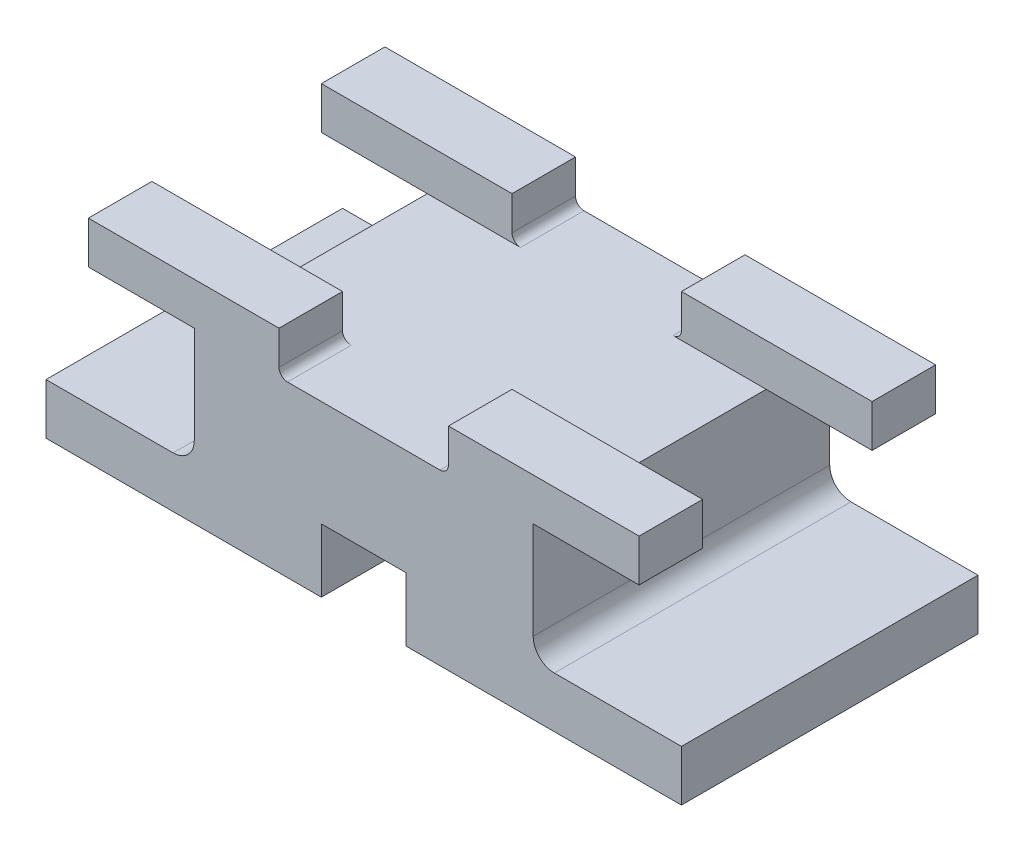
SolidWorks part; units mm, degrees
ref_plane "Ebene vorne" through (0, 0, 0) normal (0, 0, 1) x (1, 0, 0)
ref_plane "Ebene oben" through (0, 0, 0) normal (0, 1, 0) x (1, 0, 0)
ref_plane "Ebene rechts" through (0, 0, 0) normal (1, 0, 0) x (0, 0, -1)
sketch "Skizze1" plane through (0, 0, 0) normal (0, 0, 1) x (1, 0, 0)
  line L0 (0, 0) -> (0, 54.5072) construction
  line L1 (-75, 0) -> (-75, 12)
  line L2 (-75, 12) -> (-45, 12)
  line L3 (-40, 17) -> (-40, 40)
  line L4 (-40, 40) -> (-65, 40)
  line L5 (-65, 40) -> (-65, 50)
  line L6 (-65, 50) -> (-20, 50)
  line L7 (-20, 50) -> (-20, 42)
  line L8 (-18, 40) -> (18, 40)
  line L9 (-75, 0) -> (-10, 0)
  line L10 (-10, 0) -> (-10, 15)
  line L11 (-10, 15) -> (10, 15)
  line L12 (10, 0) -> (10, 15)
  line L13 (20, 50) -> (20, 42)
  line L14 (65, 50) -> (20, 50)
  line L15 (65, 40) -> (65, 50)
  line L16 (40, 40) -> (65, 40)
  line L17 (40, 17) -> (40, 40)
  line L18 (75, 12) -> (45, 12)
  line L19 (75, 0) -> (75, 12)
  line L20 (75, 0) -> (10, 0)
  arc A2 (40, 17) -> (45, 12) centre (45, 17) ccw
  arc A3 (-45, 12) -> (-40, 17) centre (-45, 17) ccw
  arc A4 (20, 42) -> (18, 40) centre (18, 42) cw
  arc A5 (-20, 42) -> (-18, 40) centre (-18, 42) ccw
  point P6 (-40, 40)
  point P16 (0, 15)
  point P18 (0, 40)
  point P21 (40, 40)
  point P25 (-75, 6)
  point P28 (-40, 40)
  point P29 (-40.7065, 40)
  point P31 (40, 40)
  point P34 (40, 12)
  point P37 (-40, 12)
  point P40 (20, 40)
  point P43 (-20, 40)
  point P44 (40.8736, 40)
  dimension "D12" = 2
  dimension "D1" = 150
  dimension "D2" = 50
  dimension "D3" = 12
  dimension "D4" = 20
  dimension "D5" = 40
  dimension "D6" = 10
  dimension "D7" = 45
  dimension "D8" = 15
  dimension "D9" = 80
  dimension "D10" = 28
extrude "Aufsatz-Linear austragen1" add sketch "Skizze1" along normal mid plane 70
sketch "Skizze2" plane through (0, 50, 0) normal (0, 1, 0) x (1, 0, 0)
  line L0 (65, -35) -> (65, 35) construction
  line L1 (-65, -20) -> (65, -20)
  line L2 (-65, -20) -> (-65, 20)
  line L3 (-65, 20) -> (65, 20)
  line L4 (65, -20) -> (65, 20)
  line L5 (-65, -20) -> (65, 20) construction
  line L6 (-65, 20) -> (65, -20) construction
  point P0 (0, 0)
  dimension "D1" = 40
extrude "Schnitt-Linear austragen1" cut sketch "Skizze2" against normal up to surface (10 mm away)
